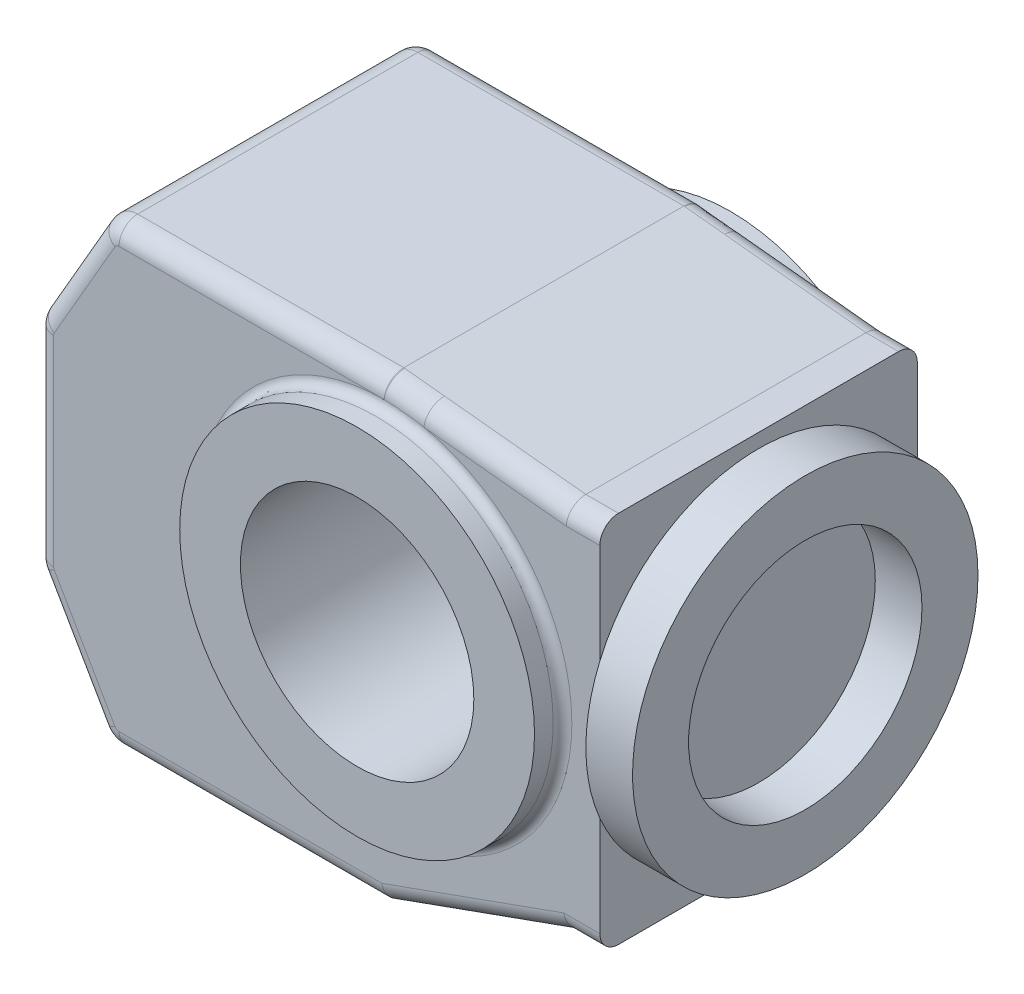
SolidWorks part; units mm, degrees
ref_plane "Front Plane" through (0, 0, 0) normal (0, 0, 1) x (1, 0, 0)
ref_plane "Top Plane" through (0, 0, 0) normal (0, 1, 0) x (1, 0, 0)
ref_plane "Right Plane" through (0, 0, 0) normal (1, 0, 0) x (0, 0, -1)
sketch "Sketch2" plane through (0, 0, 0) normal (0, 0, 1) x (1, 0, 0)
  circle A0 centre (0, 0) radius 38
  dimension "D1" = 76
extrude "Base-Extrude" add sketch "Sketch2" along normal mid plane 80
sketch "Sketch3" plane through (0, 0, 0) normal (0, 0, 1) x (1, 0, 0)
  line L0 (46, 40) -> (46, -40)
  line L1 (-75, 16.4833) -> (-75, -26.4833)
  line L2 (0, 0) -> (46, 0) construction
  line L3 (46, 40) -> (39, 40)
  line L4 (46, -40) -> (39, -40)
  line L5 (39, 40) -> (0, 44)
  line L6 (0, 44) -> (-57, 44)
  line L7 (39, -40) -> (0, -54)
  line L8 (0, -54) -> (-57, -54)
  line L9 (-57, 44) -> (-57, -54) construction
  line L10 (-61.3301, -51.5) -> (-74.3301, -28.9833)
  line L11 (-61.3301, 41.5) -> (-74.3301, 18.9833)
  circle A0 centre (0, 0) radius 38 construction
  arc A1 (-57, -54) -> (-61.3301, -51.5) centre (-57, -49) cw
  arc A2 (-57, 44) -> (-61.3301, 41.5) centre (-57, 39) ccw
  arc A3 (-75, -26.4833) -> (-74.3301, -28.9833) centre (-70, -26.4833) ccw
  arc A4 (-74.3301, 18.9833) -> (-75, 16.4833) centre (-70, 16.4833) ccw
  point P23 (-75, -27.8231)
  point P24 (-75, 17.8231)
  dimension "D4" = 46
  dimension "D7" = 5
  dimension "D10" = 5
  dimension "D1" = 80
  dimension "D2" = 4
  dimension "D3" = 14
  dimension "D5" = 121
  dimension "D6" = 18
  dimension "D8" = 18
  dimension "D9" = 26.1769
  dimension "D11" = 7
  dimension "D12" = 45.6462
extrude "Boss-Extrude1" add sketch "Sketch3" along normal mid plane 68
fillet "Fillet1" radius 2 2 edges at (38, 0, 34) (38, 0, -34)
fillet "Fillet2" radius 4 24 edges at (19.5, 42, -34) (-28.5, 44, -34) (-59.5, 43.3301, -34) (-67.8301, 30.2417, -34) (-74.8296, 17.7774, -34) (-75, -5, -34) (-74.8296, -27.7774, -34) (-67.8301, -40.2417, -34) (-59.5, -53.3301, -34) (-28.5, -54, -34) (19.5, -47, -34) (42.5, -40, -34) (19.5, 42, 34) (-28.5, 44, 34) (-59.5, 43.3301, 34) (-67.8301, 30.2417, 34) (-74.8296, 17.7774, 34) (-75, -5, 34) (-74.8296, -27.7774, 34) (-67.8301, -40.2417, 34) (-59.5, -53.3301, 34) (-28.5, -54, 34) (19.5, -47, 34) (42.5, -40, 34)
sketch "Sketch4" plane through (46, 0, 0) normal (1, 0, 0) x (0, 0, -1)
  circle A0 centre (0, 0) radius 37
  dimension "D1" = 74
extrude "Extrude1" add sketch "Sketch4" along normal blind 10
sketch "Sketch5" plane through (0, 0, 40) normal (0, 0, 1) x (1, 0, 0)
  circle A0 centre (0, 0) radius 25
  dimension "D1" = 50
extrude "Cut-Extrude1" cut sketch "Sketch5" against normal through all
sketch "Sketch6" plane through (56, -7.7118, -13.2568) normal (1, 0, 0) x (0, 0, -1)
  circle A0 centre (-13.2568, 7.7118) radius 25
  circle A1 centre (-13.2568, 7.7118) radius 37 construction
  dimension "D1" = 50
extrude "Cut-Extrude2" cut sketch "Sketch6" against normal blind 10
